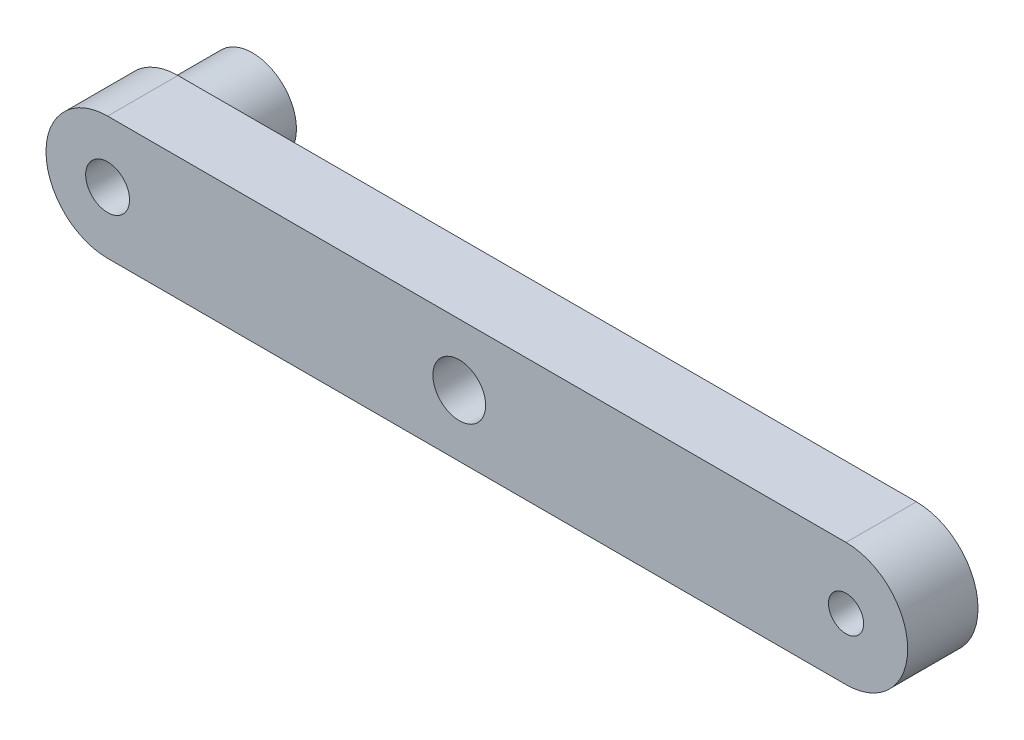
SolidWorks part; units mm, degrees
ref_plane "Front Plane" through (0, 0, 0) normal (0, 0, 1) x (1, 0, 0)
ref_plane "Top Plane" through (0, 0, 0) normal (0, 1, 0) x (1, 0, 0)
ref_plane "Right Plane" through (0, 0, 0) normal (1, 0, 0) x (0, 0, -1)
sketch "Sketch1" plane through (0, 0, 0) normal (0, 0, 1) x (1, 0, 0)
  line L0 (0, 0) -> (69.85, 0)
  line L1 (0, 0) -> (-63.5, 0)
  line L4 (69.85, 11.1252) -> (-63.5, 11.1252)
  line L6 (-63.5, -11.1252) -> (69.85, -11.1252)
  circle A0 centre (-63.5, 0) radius 3.9624
  circle A1 centre (69.85, 0) radius 3.175
  circle A2 centre (0, 0) radius 4.7625
  arc A3 (-63.5, 11.1252) -> (-63.5, -11.1252) centre (-63.5, 0) ccw
  arc A5 (69.85, -11.1252) -> (69.85, 11.1252) centre (69.85, 0) ccw
  circle A7 centre (-63.5, 0) radius 7.9375
  dimension "D1" = 6.35
  dimension "D5" = 22.2504
  dimension "D6" = 11.1252
  dimension "D7" = 7.9248
  dimension "D8" = 9.525
  dimension "D10" = 15.875
  dimension "D2" = 63.5
  dimension "D3" = 69.85
  dimension "D4" = 180
sketch "Sketch2" plane through (0, 0, 0) normal (0, 0, 1) x (1, 0, 0)
  line L2 (69.85, 11.1252) -> (-63.5, 11.1252) construction
  line L4 (-63.5, -11.1252) -> (69.85, -11.1252) construction
  line L5 (-63.5, -11.1252) -> (69.85, -11.1252)
  line L6 (69.85, 11.1252) -> (-63.5, 11.1252)
  arc A1 (69.85, -11.1252) -> (69.85, 11.1252) centre (69.85, 0) ccw construction
  arc A3 (-63.5, 11.1252) -> (-63.5, -11.1252) centre (-63.5, 0) ccw construction
  circle A4 centre (-63.5, 0) radius 3.9624 construction
  circle A5 centre (0, 0) radius 4.7625 construction
  circle A6 centre (69.85, 0) radius 3.175 construction
  arc A8 (69.85, -11.1252) -> (69.85, 11.1252) centre (69.85, 0) ccw
  arc A10 (-63.5, 11.1252) -> (-63.5, -11.1252) centre (-63.5, 0) ccw
  circle A11 centre (-63.5, 0) radius 3.9624
  circle A12 centre (0, 0) radius 4.7625
  circle A13 centre (69.85, 0) radius 3.175
extrude "Boss-Extrude1" add sketch "Sketch2" along normal blind 12.7
sketch "Sketch3" plane through (0, 0, 0) normal (0, 0, 1) x (1, 0, 0)
  circle A0 centre (-63.5, 0) radius 7.9375 construction
  circle A1 centre (-63.5, 0) radius 7.9375
extrude "Boss-Extrude2" add sketch "Sketch3" against normal blind 13.462 separate body
